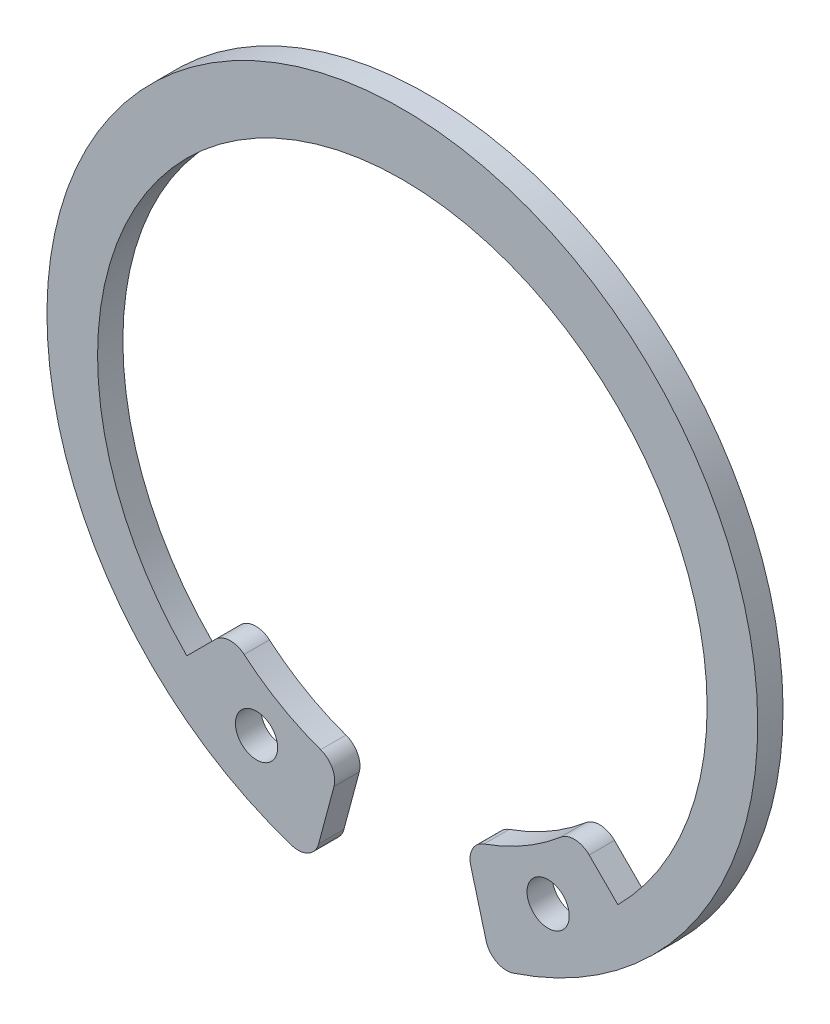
SolidWorks part; units mm, degrees
ref_plane "Plan1" through (0, 0, 0) normal (0, 0, 1) x (1, 0, 0)
ref_plane "Plan2" through (0, 0, 0) normal (0, 1, 0) x (1, 0, 0)
ref_plane "Plan3" through (0, 0, 0) normal (1, 0, 0) x (0, 0, -1)
sketch "Esquisse1" plane through (0, 0, 0) normal (0, 0, 1) x (1, 0, 0)
  line L0 (-3.7399, 13.9576) -> (2.0576, -7.6791) construction
  line L1 (0, 0) -> (0, -67.082) construction
  line L2 (3.9711, -14.8203) -> (3.2421, -12.0999)
  line L3 (0, 0) -> (7, -7) construction
  line L4 (8.8577, -8.8577) -> (10.2177, -10.2177)
  line L5 (-3.9711, -14.8203) -> (-3.2421, -12.0999)
  line L6 (-8.8577, -8.8577) -> (-10.2177, -10.2177)
  line L7 (0, 0) -> (0, 14.45) construction
  line L8 (0, 14.45) -> (0, 17.35) construction
  line L9 (-3.6066, -13.4601) -> (-10.2177, -10.2177) construction
  arc A0 (10.2177, -10.2177) -> (-10.2177, -10.2177) centre (0, 0) ccw
  arc A1 (-7.502, -8.8037) -> (-3.8732, -10.8988) centre (0, 0) ccw
  arc A2 (5.2485, -15.5117) -> (-5.2485, -15.5117) centre (0, 0.5) ccw
  arc A4 (3.8732, -10.8988) -> (7.502, -8.8037) centre (0, 0) ccw
  arc A5 (7.502, -8.8037) -> (8.8577, -8.8577) centre (8.1506, -9.5648) cw
  arc A6 (3.2421, -12.0999) -> (3.8732, -10.8988) centre (4.2081, -11.841) cw
  arc A7 (-3.2421, -12.0999) -> (-3.8732, -10.8988) centre (-4.2081, -11.841) ccw
  arc A8 (-8.8577, -8.8577) -> (-7.502, -8.8037) centre (-8.1506, -9.5648) cw
  arc A9 (-5.2485, -15.5117) -> (-3.9711, -14.8203) centre (-4.937, -14.5615) ccw
  arc A10 (5.2485, -15.5117) -> (3.9711, -14.8203) centre (4.937, -14.5615) cw
  circle A11 centre (-6.9122, -11.8389) radius 1
  circle A12 centre (6.9122, -11.8389) radius 1
  point P19 (8.1788, -8.1788)
  point P22 (2.9936, -11.1724)
  point P25 (-2.9936, -11.1724)
  point P30 (-8.1788, -8.1788)
  point P33 (-4.236, -15.8089)
  point P36 (4.236, -15.8089)
  dimension "D1" = 16.85
  dimension "D2" = 4.8
  dimension "D3" = 2.9
  dimension "D6" = 1
  dimension "D4" = 0.5
  dimension "D7" = 2
  dimension "D5" = 30
extrude "Base-Extrusion" add sketch "Esquisse1" along normal blind 1.2
equation "\"D5@Esquisse1\"=\"a@Esquisse1\"*2"
equation "\"D6@Esquisse1\"=\"D7@Esquisse1\"/2"
equation "\"D4@Esquisse1\" = \"D6@Esquisse1\"/2"
